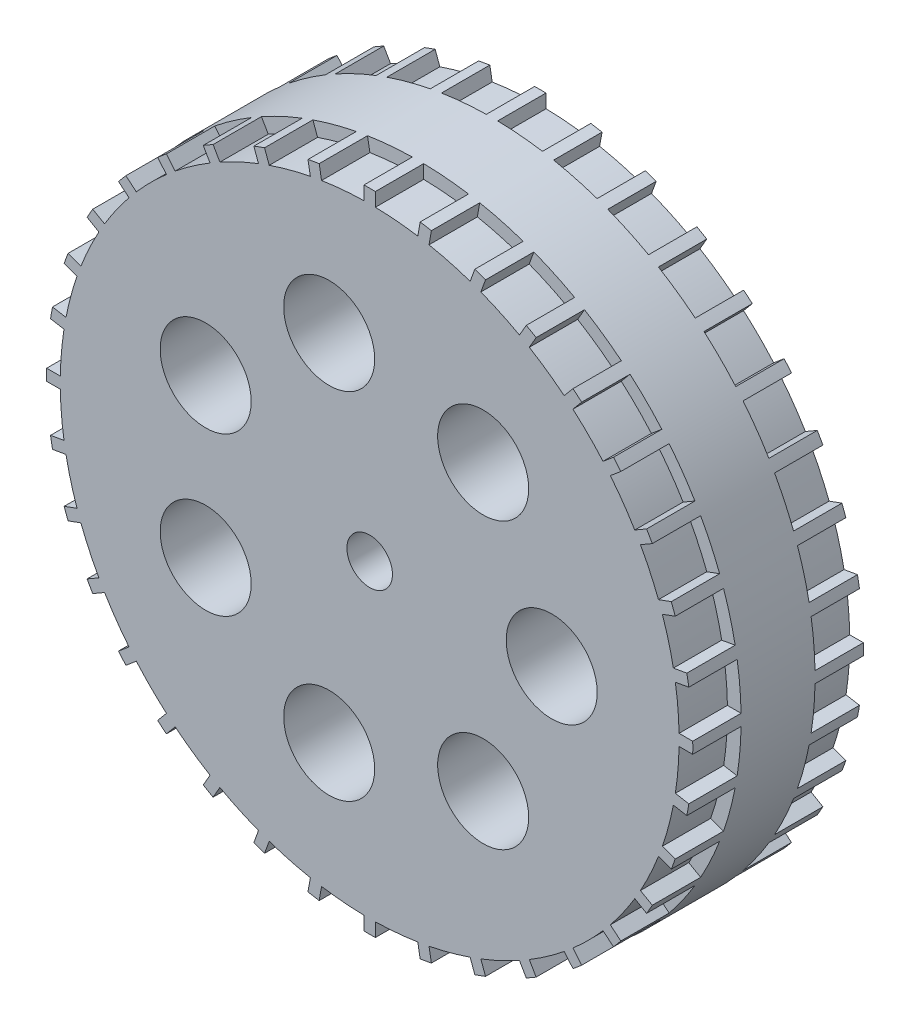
SolidWorks part; units mm, degrees
ref_plane "前视基准面" through (0, 0, 0) normal (0, 0, 1) x (1, 0, 0)
ref_plane "上视基准面" through (0, 0, 0) normal (0, 1, 0) x (1, 0, 0)
ref_plane "右视基准面" through (0, 0, 0) normal (1, 0, 0) x (0, 0, -1)
sketch "草图1" plane through (0, 0, 0) normal (0, 0, 1) x (1, 0, 0)
  circle A0 centre (0, 0) radius 27.2
  dimension "D1" = 54.4
extrude "凸台-拉伸1" add sketch "草图1" along normal blind 15
sketch "草图2" plane through (0, 0, 0) normal (0, 0, -1) x (-1, 0, 0)
  line L1 (7.0437, 0) -> (3.5218, 6.1)
  line L2 (3.5218, 6.1) -> (-3.5218, 6.1)
  line L3 (-3.5218, 6.1) -> (-7.0437, 0)
  line L4 (-7.0437, 0) -> (-3.5218, -6.1)
  line L5 (-3.5218, -6.1) -> (3.5218, -6.1)
  line L6 (3.5218, -6.1) -> (7.0437, 0)
  circle A0 centre (0, 0) radius 6.1 construction
  dimension "D1" = 12.2
extrude "切除-拉伸1" cut sketch "草图2" against normal blind 10
sketch "草图3" plane through (0, 0, 10) normal (0, 0, -1) x (-1, 0, 0)
  circle A0 centre (0, 0) radius 2
  dimension "D1" = 4
extrude "切除-拉伸2" cut sketch "草图3" against normal blind 11
sketch "草图6" plane through (0, 0, 15) normal (0, 0, 1) x (1, 0, 0)
  circle A0 centre (16, 0) radius 4
  circle A1 centre (9.9758, -12.5093) radius 4
  circle A2 centre (-3.5603, -15.5988) radius 4
  circle A3 centre (-14.4155, -6.9421) radius 4
  circle A4 centre (-14.4155, 6.9421) radius 4
  circle A5 centre (-3.5603, 15.5988) radius 4
  circle A6 centre (9.9758, 12.5093) radius 4
  circle A7 centre (0, 0) radius 2 construction
  point P16 (0, 0)
  point P19 (0, 0)
  dimension "D1" = 8
  dimension "D2" = 7
  dimension "D3" = 16
extrude "切除-拉伸5" cut sketch "草图6" against normal blind 30
sketch "草图7" plane through (0, 0, 15) normal (0, 0, 1) x (1, 0, 0)
  line L0 (0, 27.2) -> (0, 28.4) construction
  line L1 (-0.5, 28.3956) -> (-0.5, 27.1954)
  line L2 (0.5, 28.3956) -> (0.5, 27.1954)
  line L3 (4.4384, 28.051) -> (4.23, 26.8691)
  line L4 (5.4232, 27.8774) -> (5.2148, 26.6954)
  line L5 (9.242, 26.8541) -> (8.8315, 25.7263)
  line L6 (10.1817, 26.5121) -> (9.7712, 25.3843)
  line L7 (13.7648, 24.8413) -> (13.1647, 23.8019)
  line L8 (14.6308, 24.3413) -> (14.0307, 23.3019)
  line L9 (17.8693, 22.0737) -> (17.0978, 21.1543)
  line L10 (18.6354, 21.4309) -> (17.8639, 20.5115)
  line L11 (21.4309, 18.6354) -> (20.5115, 17.8639)
  line L12 (22.0737, 17.8693) -> (21.1543, 17.0978)
  line L13 (24.3413, 14.6308) -> (23.3019, 14.0307)
  line L14 (24.8413, 13.7648) -> (23.8019, 13.1647)
  line L15 (26.5121, 10.1817) -> (25.3843, 9.7712)
  line L16 (26.8541, 9.242) -> (25.7263, 8.8315)
  line L17 (27.8774, 5.4232) -> (26.6954, 5.2148)
  line L18 (28.051, 4.4384) -> (26.8691, 4.23)
  line L19 (28.3956, 0.5) -> (27.1954, 0.5)
  line L20 (28.3956, -0.5) -> (27.1954, -0.5)
  line L21 (28.051, -4.4384) -> (26.8691, -4.23)
  line L22 (27.8774, -5.4232) -> (26.6954, -5.2148)
  line L23 (26.8541, -9.242) -> (25.7263, -8.8315)
  line L24 (26.5121, -10.1817) -> (25.3843, -9.7712)
  line L25 (24.8413, -13.7648) -> (23.8019, -13.1647)
  line L26 (24.3413, -14.6308) -> (23.3019, -14.0307)
  line L27 (22.0737, -17.8693) -> (21.1543, -17.0978)
  line L28 (21.4309, -18.6354) -> (20.5115, -17.8639)
  line L29 (18.6354, -21.4309) -> (17.8639, -20.5115)
  line L30 (17.8693, -22.0737) -> (17.0978, -21.1543)
  line L31 (14.6308, -24.3413) -> (14.0307, -23.3019)
  line L32 (13.7648, -24.8413) -> (13.1647, -23.8019)
  line L33 (10.1817, -26.5121) -> (9.7712, -25.3843)
  line L34 (9.242, -26.8541) -> (8.8315, -25.7263)
  line L35 (5.4232, -27.8774) -> (5.2148, -26.6954)
  line L36 (4.4384, -28.051) -> (4.23, -26.8691)
  line L37 (0.5, -28.3956) -> (0.5, -27.1954)
  line L38 (-0.5, -28.3956) -> (-0.5, -27.1954)
  line L39 (-4.4384, -28.051) -> (-4.23, -26.8691)
  line L40 (-5.4232, -27.8774) -> (-5.2148, -26.6954)
  line L41 (-9.242, -26.8541) -> (-8.8315, -25.7263)
  line L42 (-10.1817, -26.5121) -> (-9.7712, -25.3843)
  line L43 (-13.7648, -24.8413) -> (-13.1647, -23.8019)
  line L44 (-14.6308, -24.3413) -> (-14.0307, -23.3019)
  line L45 (-17.8693, -22.0737) -> (-17.0978, -21.1543)
  line L46 (-18.6354, -21.4309) -> (-17.8639, -20.5115)
  line L47 (-21.4309, -18.6354) -> (-20.5115, -17.8639)
  line L48 (-22.0737, -17.8693) -> (-21.1543, -17.0978)
  line L49 (-24.3413, -14.6308) -> (-23.3019, -14.0307)
  line L50 (-24.8413, -13.7648) -> (-23.8019, -13.1647)
  line L51 (-26.5121, -10.1817) -> (-25.3843, -9.7712)
  line L52 (-26.8541, -9.242) -> (-25.7263, -8.8315)
  line L53 (-27.8774, -5.4232) -> (-26.6954, -5.2148)
  line L54 (-28.051, -4.4384) -> (-26.8691, -4.23)
  line L55 (-28.3956, -0.5) -> (-27.1954, -0.5)
  line L56 (-28.3956, 0.5) -> (-27.1954, 0.5)
  line L57 (-28.051, 4.4384) -> (-26.8691, 4.23)
  line L58 (-27.8774, 5.4232) -> (-26.6954, 5.2148)
  line L59 (-26.8541, 9.242) -> (-25.7263, 8.8315)
  line L60 (-26.5121, 10.1817) -> (-25.3843, 9.7712)
  line L61 (-24.8413, 13.7648) -> (-23.8019, 13.1647)
  line L62 (-24.3413, 14.6308) -> (-23.3019, 14.0307)
  line L63 (-22.0737, 17.8693) -> (-21.1543, 17.0978)
  line L64 (-21.4309, 18.6354) -> (-20.5115, 17.8639)
  line L65 (-18.6354, 21.4309) -> (-17.8639, 20.5115)
  line L66 (-17.8693, 22.0737) -> (-17.0978, 21.1543)
  line L67 (-14.6308, 24.3413) -> (-14.0307, 23.3019)
  line L68 (-13.7648, 24.8413) -> (-13.1647, 23.8019)
  line L69 (-10.1817, 26.5121) -> (-9.7712, 25.3843)
  line L70 (-9.242, 26.8541) -> (-8.8315, 25.7263)
  line L71 (-5.4232, 27.8774) -> (-5.2148, 26.6954)
  line L72 (-4.4384, 28.051) -> (-4.23, 26.8691)
  arc A0 (0.5, 27.1954) -> (-0.5, 27.1954) centre (0, 0) ccw
  arc A1 (0.5, 28.3956) -> (-0.5, 28.3956) centre (0, 0) ccw
  arc A2 (5.4232, 27.8774) -> (4.4384, 28.051) centre (0, 0) ccw
  arc A3 (5.2148, 26.6954) -> (4.23, 26.8691) centre (0, 0) ccw
  arc A4 (10.1817, 26.5121) -> (9.242, 26.8541) centre (0, 0) ccw
  arc A5 (9.7712, 25.3843) -> (8.8315, 25.7263) centre (0, 0) ccw
  arc A6 (14.6308, 24.3413) -> (13.7648, 24.8413) centre (0, 0) ccw
  arc A7 (14.0307, 23.3019) -> (13.1647, 23.8019) centre (0, 0) ccw
  arc A8 (18.6354, 21.4309) -> (17.8693, 22.0737) centre (0, 0) ccw
  arc A9 (17.8639, 20.5115) -> (17.0978, 21.1543) centre (0, 0) ccw
  arc A10 (22.0737, 17.8693) -> (21.4309, 18.6354) centre (0, 0) ccw
  arc A11 (21.1543, 17.0978) -> (20.5115, 17.8639) centre (0, 0) ccw
  arc A12 (24.8413, 13.7648) -> (24.3413, 14.6308) centre (0, 0) ccw
  arc A13 (23.8019, 13.1647) -> (23.3019, 14.0307) centre (0, 0) ccw
  arc A14 (26.8541, 9.242) -> (26.5121, 10.1817) centre (0, 0) ccw
  arc A15 (25.7263, 8.8315) -> (25.3843, 9.7712) centre (0, 0) ccw
  arc A16 (28.051, 4.4384) -> (27.8774, 5.4232) centre (0, 0) ccw
  arc A17 (26.8691, 4.23) -> (26.6954, 5.2148) centre (0, 0) ccw
  arc A18 (28.3956, -0.5) -> (28.3956, 0.5) centre (0, 0) ccw
  arc A19 (27.1954, -0.5) -> (27.1954, 0.5) centre (0, 0) ccw
  arc A20 (27.8774, -5.4232) -> (28.051, -4.4384) centre (0, 0) ccw
  arc A21 (26.6954, -5.2148) -> (26.8691, -4.23) centre (0, 0) ccw
  arc A22 (26.5121, -10.1817) -> (26.8541, -9.242) centre (0, 0) ccw
  arc A23 (25.3843, -9.7712) -> (25.7263, -8.8315) centre (0, 0) ccw
  arc A24 (24.3413, -14.6308) -> (24.8413, -13.7648) centre (0, 0) ccw
  arc A25 (23.3019, -14.0307) -> (23.8019, -13.1647) centre (0, 0) ccw
  arc A26 (21.4309, -18.6354) -> (22.0737, -17.8693) centre (0, 0) ccw
  arc A27 (20.5115, -17.8639) -> (21.1543, -17.0978) centre (0, 0) ccw
  arc A28 (17.8693, -22.0737) -> (18.6354, -21.4309) centre (0, 0) ccw
  arc A29 (17.0978, -21.1543) -> (17.8639, -20.5115) centre (0, 0) ccw
  arc A30 (13.7648, -24.8413) -> (14.6308, -24.3413) centre (0, 0) ccw
  arc A31 (13.1647, -23.8019) -> (14.0307, -23.3019) centre (0, 0) ccw
  arc A32 (9.242, -26.8541) -> (10.1817, -26.5121) centre (0, 0) ccw
  arc A33 (8.8315, -25.7263) -> (9.7712, -25.3843) centre (0, 0) ccw
  arc A34 (4.4384, -28.051) -> (5.4232, -27.8774) centre (0, 0) ccw
  arc A35 (4.23, -26.8691) -> (5.2148, -26.6954) centre (0, 0) ccw
  arc A36 (-0.5, -28.3956) -> (0.5, -28.3956) centre (0, 0) ccw
  arc A37 (-0.5, -27.1954) -> (0.5, -27.1954) centre (0, 0) ccw
  arc A38 (-5.4232, -27.8774) -> (-4.4384, -28.051) centre (0, 0) ccw
  arc A39 (-5.2148, -26.6954) -> (-4.23, -26.8691) centre (0, 0) ccw
  arc A40 (-10.1817, -26.5121) -> (-9.242, -26.8541) centre (0, 0) ccw
  arc A41 (-9.7712, -25.3843) -> (-8.8315, -25.7263) centre (0, 0) ccw
  arc A42 (-14.6308, -24.3413) -> (-13.7648, -24.8413) centre (0, 0) ccw
  arc A43 (-14.0307, -23.3019) -> (-13.1647, -23.8019) centre (0, 0) ccw
  arc A44 (-18.6354, -21.4309) -> (-17.8693, -22.0737) centre (0, 0) ccw
  arc A45 (-17.8639, -20.5115) -> (-17.0978, -21.1543) centre (0, 0) ccw
  arc A46 (-22.0737, -17.8693) -> (-21.4309, -18.6354) centre (0, 0) ccw
  arc A47 (-21.1543, -17.0978) -> (-20.5115, -17.8639) centre (0, 0) ccw
  arc A48 (-24.8413, -13.7648) -> (-24.3413, -14.6308) centre (0, 0) ccw
  arc A49 (-23.8019, -13.1647) -> (-23.3019, -14.0307) centre (0, 0) ccw
  arc A50 (-26.8541, -9.242) -> (-26.5121, -10.1817) centre (0, 0) ccw
  arc A51 (-25.7263, -8.8315) -> (-25.3843, -9.7712) centre (0, 0) ccw
  arc A52 (-28.051, -4.4384) -> (-27.8774, -5.4232) centre (0, 0) ccw
  arc A53 (-26.8691, -4.23) -> (-26.6954, -5.2148) centre (0, 0) ccw
  arc A54 (-28.3956, 0.5) -> (-28.3956, -0.5) centre (0, 0) ccw
  arc A55 (-27.1954, 0.5) -> (-27.1954, -0.5) centre (0, 0) ccw
  arc A56 (-27.8774, 5.4232) -> (-28.051, 4.4384) centre (0, 0) ccw
  arc A57 (-26.6954, 5.2148) -> (-26.8691, 4.23) centre (0, 0) ccw
  arc A58 (-26.5121, 10.1817) -> (-26.8541, 9.242) centre (0, 0) ccw
  arc A59 (-25.3843, 9.7712) -> (-25.7263, 8.8315) centre (0, 0) ccw
  arc A60 (-24.3413, 14.6308) -> (-24.8413, 13.7648) centre (0, 0) ccw
  arc A61 (-23.3019, 14.0307) -> (-23.8019, 13.1647) centre (0, 0) ccw
  arc A62 (-21.4309, 18.6354) -> (-22.0737, 17.8693) centre (0, 0) ccw
  arc A63 (-20.5115, 17.8639) -> (-21.1543, 17.0978) centre (0, 0) ccw
  arc A64 (-17.8693, 22.0737) -> (-18.6354, 21.4309) centre (0, 0) ccw
  arc A65 (-17.0978, 21.1543) -> (-17.8639, 20.5115) centre (0, 0) ccw
  arc A66 (-13.7648, 24.8413) -> (-14.6308, 24.3413) centre (0, 0) ccw
  arc A67 (-13.1647, 23.8019) -> (-14.0307, 23.3019) centre (0, 0) ccw
  arc A68 (-9.242, 26.8541) -> (-10.1817, 26.5121) centre (0, 0) ccw
  arc A69 (-8.8315, 25.7263) -> (-9.7712, 25.3843) centre (0, 0) ccw
  arc A70 (-4.4384, 28.051) -> (-5.4232, 27.8774) centre (0, 0) ccw
  arc A71 (-4.23, 26.8691) -> (-5.2148, 26.6954) centre (0, 0) ccw
  point P150 (0, 0)
  dimension "D1" = 54.4
  dimension "D2" = 56.8
  dimension "D3" = 0.5
  dimension "D4" = 36
extrude "凸台-拉伸2" add sketch "草图7" against normal up to surface (15 mm away)
ref_plane "基准面1" through (0, 0, 7.5) normal (0, 0, 1) x (1, 0, 0)
sketch "草图10" plane through (0, 0, 7.5) normal (0, 0, 1) x (1, 0, 0)
  circle A0 centre (0, 0) radius 28.4
  circle A1 centre (0, 0) radius 27.2
extrude "凸台-拉伸3" add sketch "草图10" along normal blind 3.25
mirror "镜向1" about plane through (0, 0, 7.5) normal (0, 0, 1) of "凸台-拉伸3"
